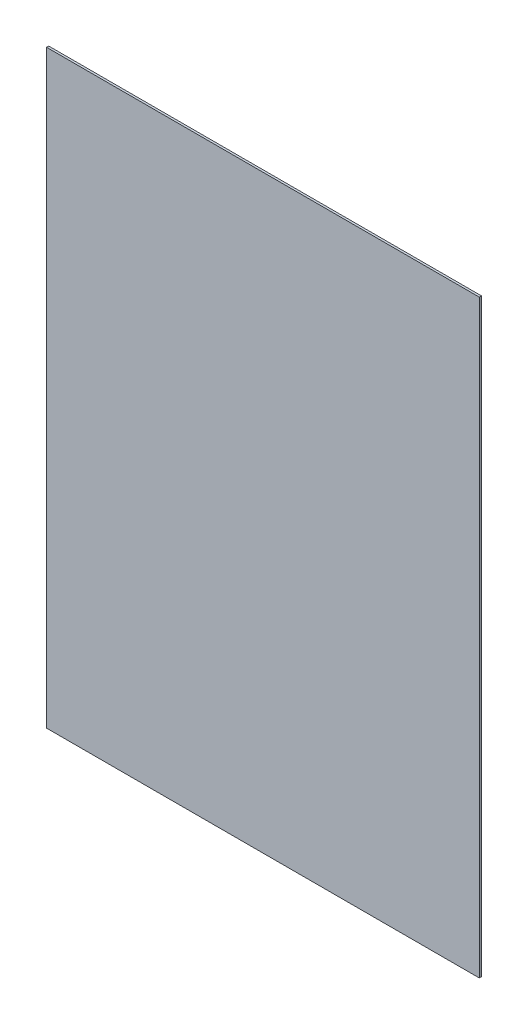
SolidWorks part; units mm, degrees
ref_plane "Ebene vorne" through (0, 0, 0) normal (0, 0, 1) x (1, 0, 0)
ref_plane "Ebene oben" through (0, 0, 0) normal (0, 1, 0) x (1, 0, 0)
ref_plane "Ebene rechts" through (0, 0, 0) normal (1, 0, 0) x (0, 0, -1)
sketch "Skizze1" plane through (0, 0, 0) normal (0, 0, 1) x (1, 0, 0)
  line L1 (0, 0) -> (800, 0)
  line L2 (0, 0) -> (0, 1090)
  line L3 (0, 1090) -> (800, 1090)
  line L4 (800, 0) -> (800, 1090)
  dimension "D1" = 800
  dimension "D2" = 1090
extrude "Aufsatz-Linear austragen1" add sketch "Skizze1" along normal blind 4
